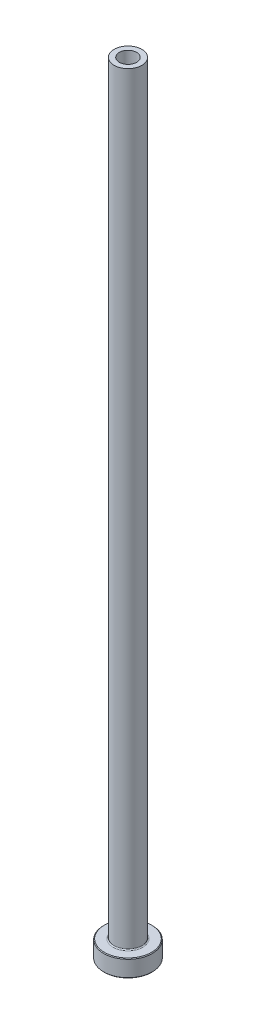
SolidWorks part; units mm, degrees
ref_plane "Front Plane" through (0, 0, 0) normal (0, 0, 1) x (1, 0, 0)
ref_plane "Top Plane" through (0, 0, 0) normal (0, 1, 0) x (1, 0, 0)
ref_plane "Right Plane" through (0, 0, 0) normal (1, 0, 0) x (0, 0, -1)
sketch "Sketch1" plane through (0, 0, 0) normal (0, 0, 1) x (1, 0, 0)
  line L0 (-2.5, 225) -> (-4, 225)
  line L1 (-4, 225) -> (-4, 5)
  line L2 (-4, 5) -> (-7, 5)
  line L3 (-7, 5) -> (-7, 0)
  line L4 (7.7, 0) -> (-7.7, 0) construction
  line L5 (-7, 0) -> (-2.75, 0)
  line L6 (-2.5, 180) -> (-2.5, 225)
  line L7 (0, 92.1877) -> (0, -15.5353) construction
  line L8 (0, -7.7) -> (0, 7.7) construction
  line L9 (-2.5, 180) -> (-2.75, 168)
  line L10 (-2.75, 168) -> (-2.75, 0)
  dimension "D1" = 0.25
  dimension "ID" = 5
  dimension "OD" = 8
  dimension "L" = 225
  dimension "H" = 14
  dimension "T" = 5
  dimension "N" = 45
  dimension "D2" = 12
revolve "Revolve1" add sketch "Sketch1" angle 360 about L7
fillet "Fillet1" radius 0.3 1 edges at (0, 5, 4)
chamfer "Chamfer1" distance 0.2 angle 45 2 edges at (0, 5, 7) (0, 0, 7)
chamfer "Chamfer3" distance 0.5 angle 45 1 edges at (0, 0, 2.75)
